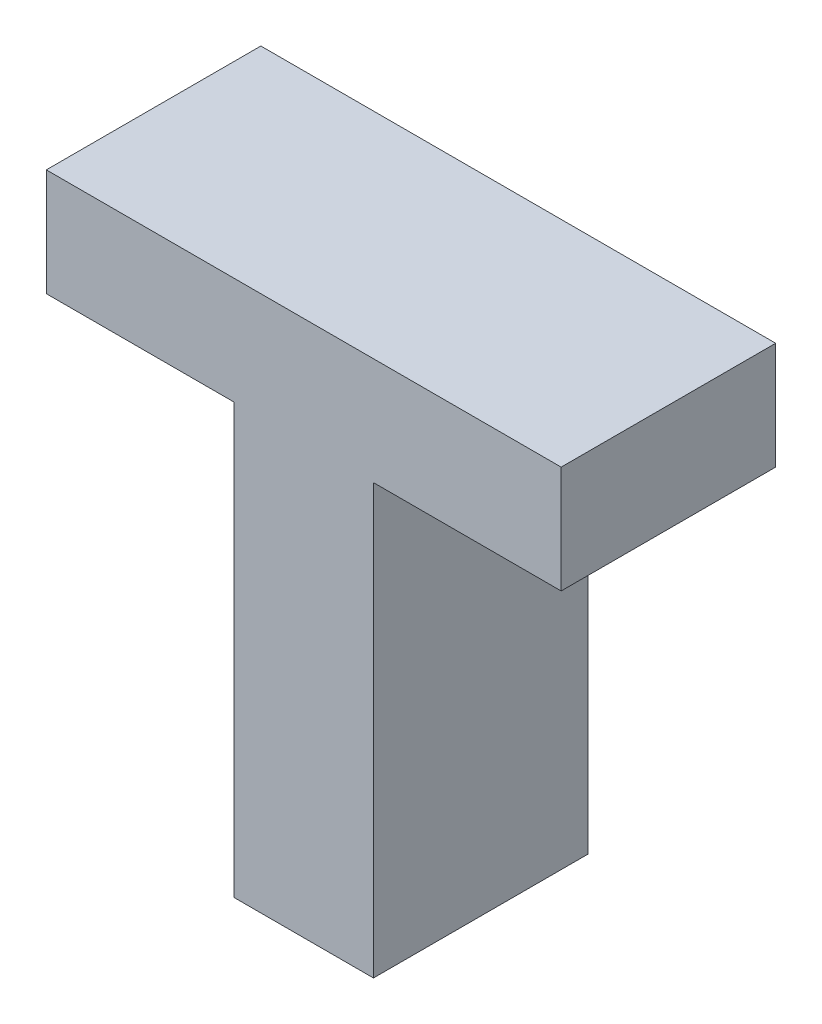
SolidWorks part; units mm, degrees
ref_plane "Front Plane" through (0, 0, 0) normal (0, 0, 1) x (1, 0, 0)
ref_plane "Top Plane" through (0, 0, 0) normal (0, 1, 0) x (1, 0, 0)
ref_plane "Right Plane" through (0, 0, 0) normal (1, 0, 0) x (0, 0, -1)
sketch "Sketch2" plane through (0, 0, 0) normal (0, 0, 1) x (1, 0, 0)
  line L0 (26, 80) -> (61, 80)
  line L1 (-35, 100) -> (61, 100)
  line L2 (-35, 100) -> (-35, 80)
  line L3 (-35, 80) -> (0, 80)
  line L4 (61, 100) -> (61, 80)
  line L5 (13, 0) -> (13, 100) construction
  line L6 (0, 80) -> (0, 0)
  line L7 (0, 0) -> (26, 0)
  line L8 (26, 80) -> (26, 0)
  dimension "D1" = 26
  dimension "D2" = 20
  dimension "D3" = 96
  dimension "D4" = 48
  dimension "D5" = 80
extrude "Extrude1" add sketch "Sketch2" along normal blind 40
